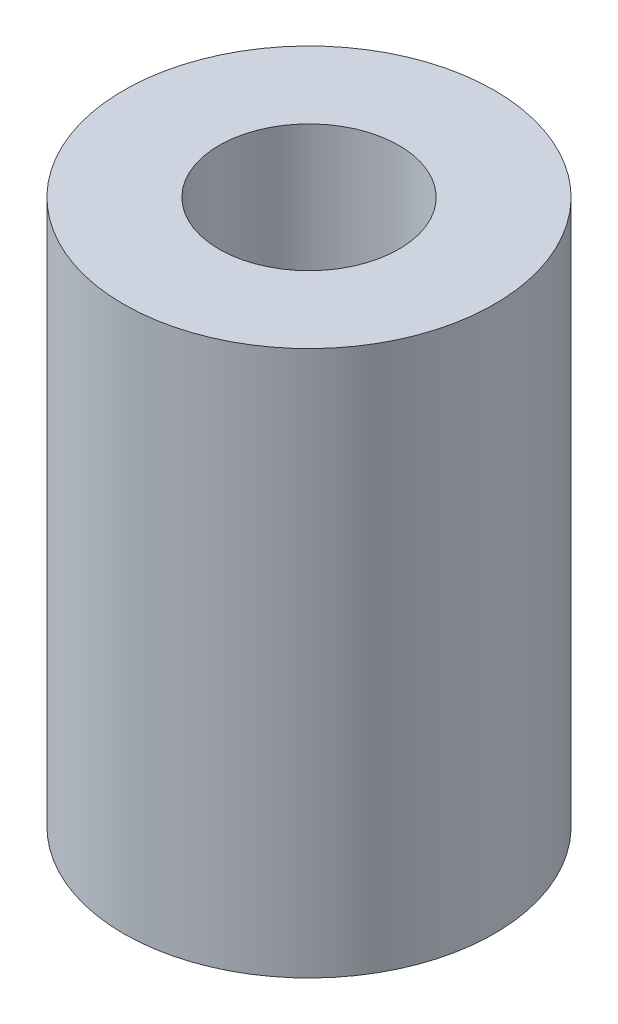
SolidWorks part; units mm, degrees
ref_plane "Plan de face" through (0, 0, 0) normal (0, 0, 1) x (1, 0, 0)
ref_plane "Plan de dessus" through (0, 0, 0) normal (0, 1, 0) x (1, 0, 0)
ref_plane "Plan de droite" through (0, 0, 0) normal (1, 0, 0) x (0, 0, -1)
sketch "Esquisse1" plane through (0, 0, 0) normal (0, 1, 0) x (1, 0, 0)
  circle A0 centre (0, 0) radius 3.4
  circle A1 centre (0, 0) radius 1.65
  dimension "D1" = 3.3
  dimension "D2" = 6.8
extrude "Boss.-Extru.1" add sketch "Esquisse1" along normal blind 10
